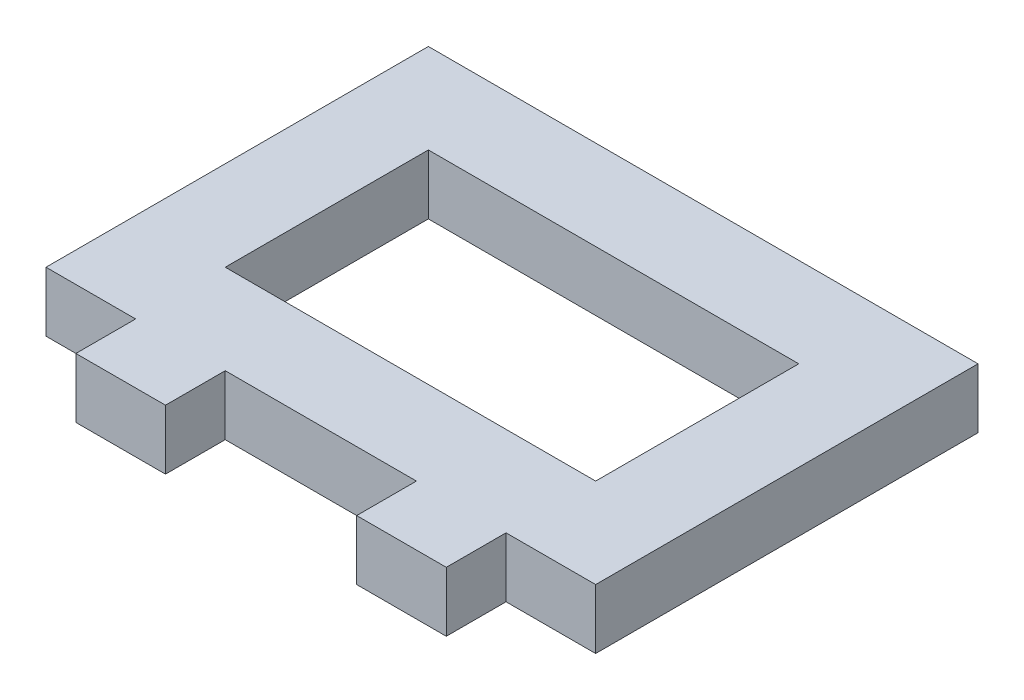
SolidWorks part; units mm, degrees
ref_plane "Front Plane" through (0, 0, 0) normal (0, 0, 1) x (1, 0, 0)
ref_plane "Top Plane" through (0, 0, 0) normal (0, 1, 0) x (1, 0, 0)
ref_plane "Right Plane" through (0, 0, 0) normal (1, 0, 0) x (0, 0, -1)
sketch "Sketch1" plane through (0, 0, 0) normal (0, 1, 0) x (1, 0, 0)
  line L4 (0, 0) -> (46, 0)
  line L5 (46, 0) -> (46, -32)
  line L6 (46, -32) -> (38.5, -32)
  line L7 (15, -32) -> (15, -37)
  line L8 (15, -37) -> (7.5, -37)
  line L9 (7.5, -37) -> (7.5, -32)
  line L10 (7.5, -32) -> (0, -32)
  line L11 (0, -32) -> (0, 0)
  line L12 (7.5, -7.5) -> (7.5, -24.5)
  line L13 (7.5, -24.5) -> (38.5, -24.5)
  line L14 (38.5, -24.5) -> (38.5, -7.5)
  line L15 (38.5, -7.5) -> (7.5, -7.5)
  line L16 (31, -32) -> (31, -37)
  line L17 (31, -37) -> (38.5, -37)
  line L18 (38.5, -37) -> (38.5, -32)
  line L19 (31, -32) -> (15, -32)
  dimension "D1" = 46
  dimension "D2" = 32
  dimension "D3" = 7.5
  dimension "D4" = 5
  dimension "D5" = 5
  dimension "D6" = 7.5
  dimension "D7" = 31
  dimension "D8" = 17
  dimension "D9" = 7.5
  dimension "D10" = 7.5
  dimension "D11" = 5
extrude "Boss-Extrude1" add sketch "Sketch1" along normal blind 5 contours L4 L5 L6 L18 L17 L16 L19 L7 L8 L9 L10 L11 | L15 L12 L13 L14
